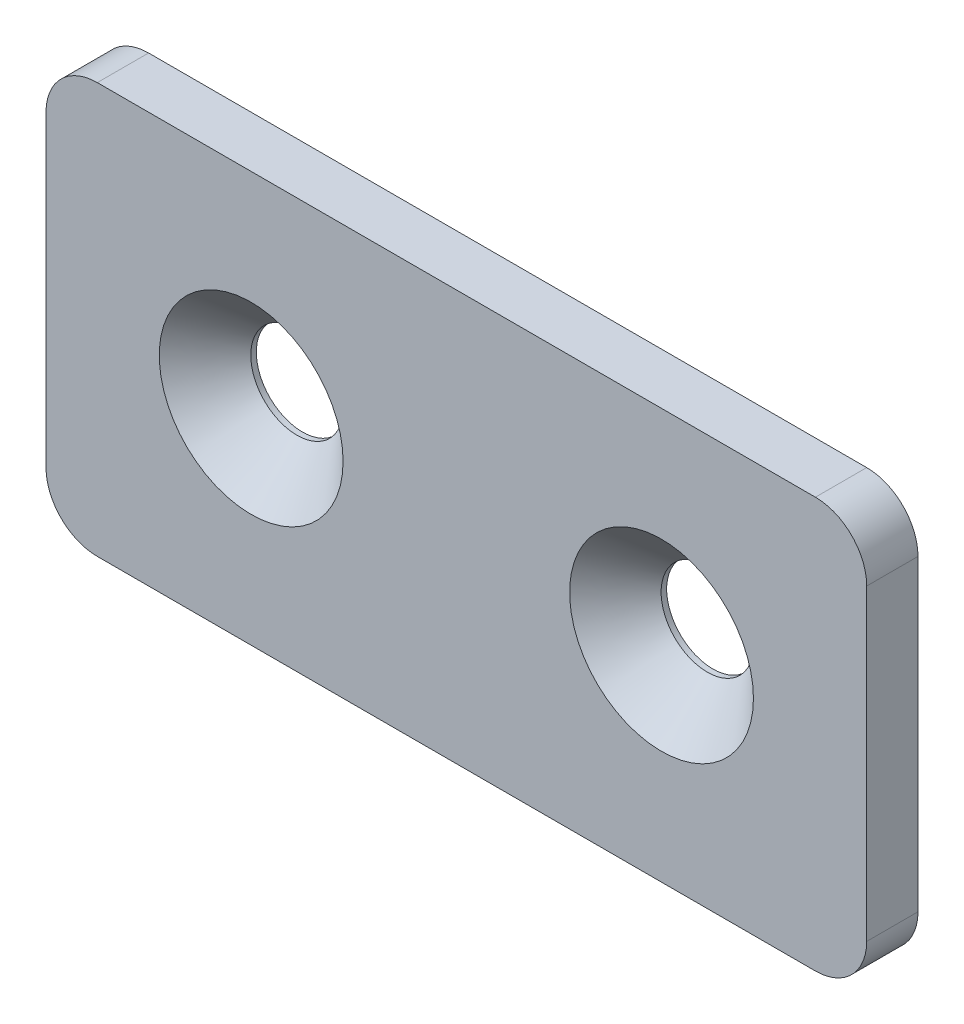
SolidWorks part; units mm, degrees
ref_plane "Alzado" through (0, 0, 0) normal (0, 0, 1) x (1, 0, 0)
ref_plane "Planta" through (0, 0, 0) normal (0, 1, 0) x (1, 0, 0)
ref_plane "Vista lateral" through (0, 0, 0) normal (1, 0, 0) x (0, 0, -1)
sketch "Croquis1" plane through (0, 0, 0) normal (0, 0, 1) x (1, 0, 0)
  line L1 (40, 20) -> (-40, 20)
  line L2 (40, 20) -> (40, -20)
  line L3 (40, -20) -> (-40, -20)
  line L4 (-40, 20) -> (-40, -20)
extrude "Extruir1" add sketch "Croquis1" along normal blind 5
fillet "Redondeo1" radius 5 4 edges at (-40, -20, 2.5) (40, -20, 2.5) (40, 20, 2.5) (-40, 20, 2.5)
hole_wizard "Refrentado para tornillo tapón de cabeza plana de clavija de M81" positions "Croquis3D4" profile "Croquis4" countersink size "M8" standard "Métrico Ansi"
sketch3d "Croquis3D4"
  point P0 (-20, 0, 5)
  point P2 (20, 0, 5)
sketch "Croquis4" plane through (-20, 0, 5) normal (1, 0, 0) x (0, -1, 0)
  line L0 (0, 0) -> (0, 5)
  line L1 (0, 5) -> (4.5, 5)
  line L2 (4.5, 5) -> (4.5, 4.46)
  line L3 (4.5, 4.46) -> (8.96, 0)
  line L5 (8.96, 0) -> (0, 0)
  line L6 (-4.5, 4.46) -> (-8.96, 0) construction
  line L11 (0, -6.35) -> (0, 107.95) construction
  dimension "Diámetro de taladro hasta el siguiente" = 9
  dimension "Profundidad de taladro hasta el siguiente" = 5
  dimension "Diámetro de avellanado cercano" = 17.92
  dimension "Ángulo de avellanado cercano" = 90
